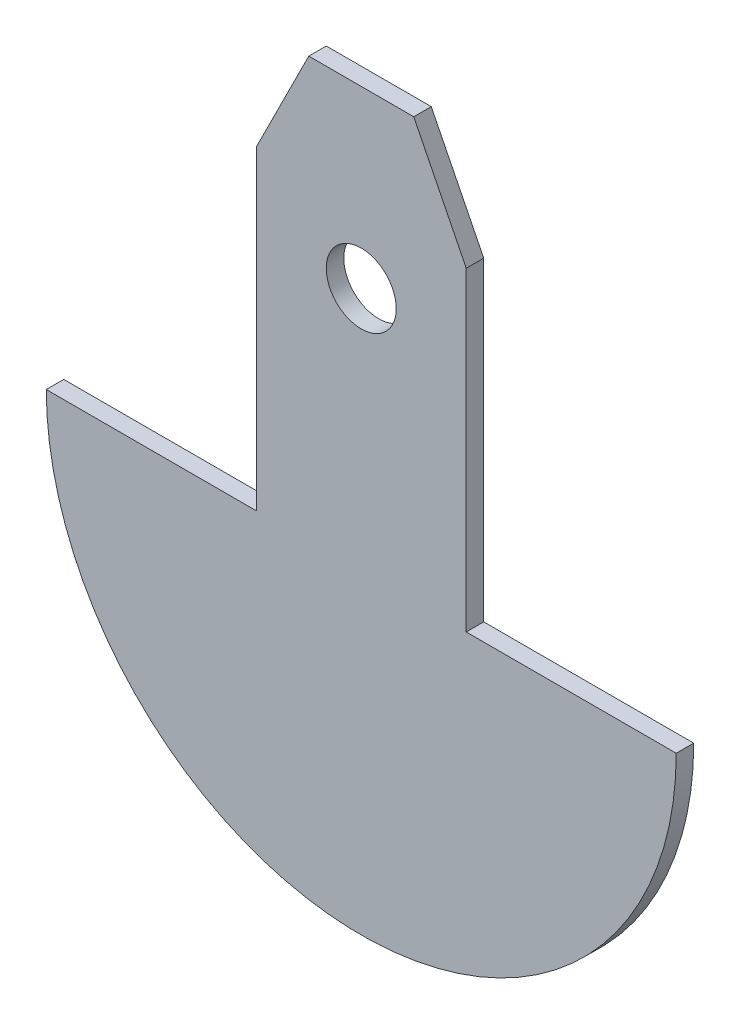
SolidWorks part; units mm, degrees
ref_plane "Front Plane" through (0, 0, 0) normal (0, 0, 1) x (1, 0, 0)
ref_plane "Top Plane" through (0, 0, 0) normal (0, 1, 0) x (1, 0, 0)
ref_plane "Right Plane" through (0, 0, 0) normal (1, 0, 0) x (0, 0, -1)
sketch "Sketch1" plane through (0, 0, 0) normal (0, 0, 1) x (1, 0, 0)
  line L0 (76.2, 0) -> (0, 0)
  line L1 (152.4, 0) -> (228.6, 0)
  line L2 (114.3, 152.4) -> (95.25, 152.4)
  line L3 (114.3, 152.4) -> (133.35, 152.4)
  line L4 (76.2, 114.3) -> (76.2, 0)
  line L5 (152.4, 114.3) -> (152.4, 0)
  line L7 (76.2, 114.3) -> (95.25, 152.4)
  line L8 (133.35, 152.4) -> (152.4, 114.3)
  arc A0 (0, 0) -> (228.6, 0) centre (114.3, 0) ccw
  dimension "D1" = 228.6
extrude "Extrude1" add sketch "Sketch1" along normal blind 6.35
sketch "Sketch2" plane through (0, 0, 6.35) normal (0, 0, 1) x (1, 0, 0)
  circle A0 centre (114.3, 88.9) radius 12.7
extrude "Extrude2" cut sketch "Sketch2" against normal through all
